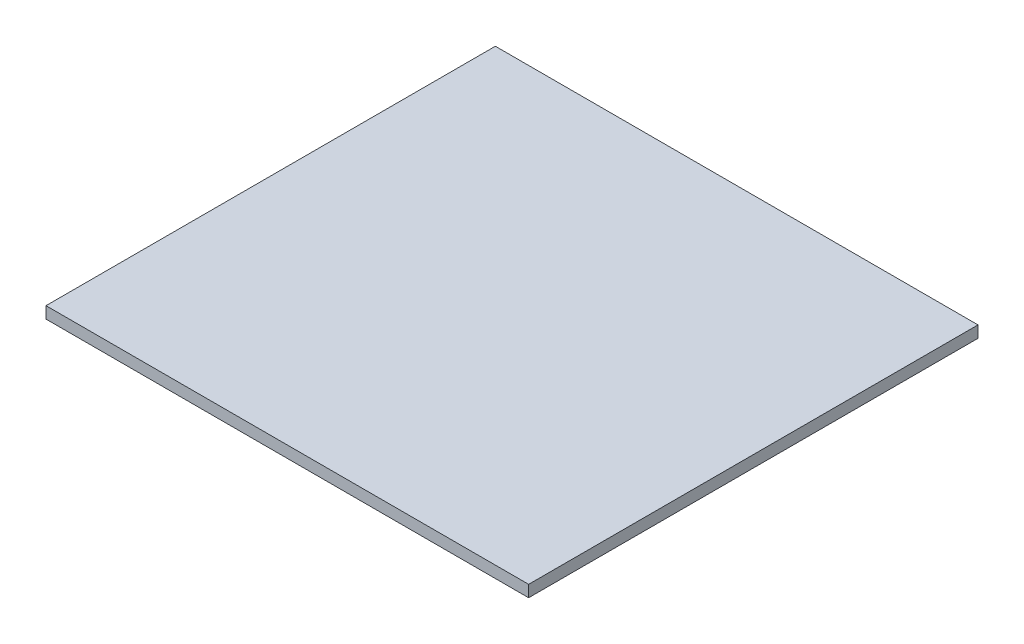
SolidWorks part; units mm, degrees
ref_plane "Ebene vorne" through (0, 0, 0) normal (0, 0, 1) x (1, 0, 0)
ref_plane "Ebene oben" through (0, 0, 0) normal (0, 1, 0) x (1, 0, 0)
ref_plane "Ebene rechts" through (0, 0, 0) normal (1, 0, 0) x (0, 0, -1)
sketch "Skizze1" plane through (0, 0, 0) normal (0, 1, 0) x (1, 0, 0)
  line L1 (-145, -135) -> (145, -135)
  line L2 (-145, -135) -> (-145, 135)
  line L3 (-145, 135) -> (145, 135)
  line L4 (145, -135) -> (145, 135)
  line L5 (-145, -135) -> (145, 135) construction
  line L6 (-145, 135) -> (145, -135) construction
  point P0 (0, 0)
  dimension "D1" = 290
  dimension "D2" = 270
extrude "Aufsatz-Linear austragen1" add sketch "Skizze1" along normal blind 7
